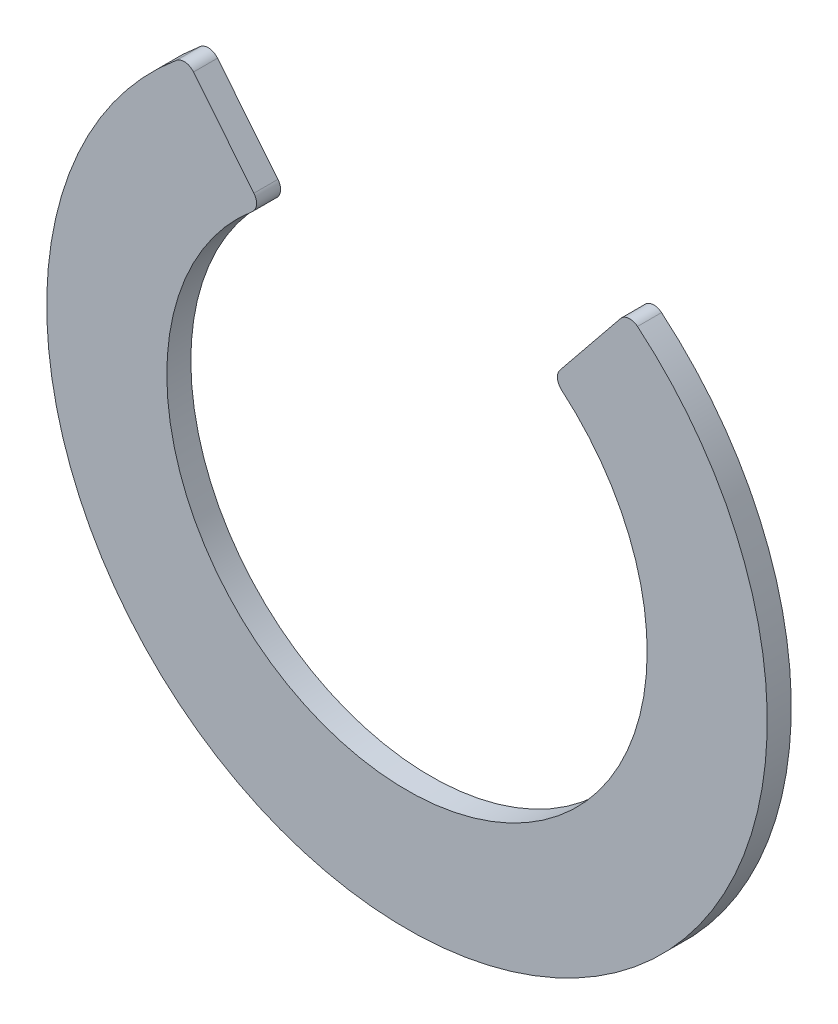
SolidWorks part; units mm, degrees
ref_plane "Front Plane" through (0, 0, 0) normal (0, 0, 1) x (1, 0, 0)
ref_plane "Top Plane" through (0, 0, 0) normal (0, 1, 0) x (1, 0, 0)
ref_plane "Right Plane" through (0, 0, 0) normal (1, 0, 0) x (0, 0, -1)
sketch "Sketch1" plane through (0, 0, 0) normal (0, 0, 1) x (1, 0, 0)
  line L0 (-1.7779, 2.2915) -> (-1.2748, 1.6693)
  line L1 (1.2748, 1.6693) -> (1.7779, 2.2915)
  arc A0 (1.9196, 2.3055) -> (-1.9196, 2.3055) centre (0, 0) cw
  arc A1 (1.2881, 1.5299) -> (-1.2881, 1.5299) centre (0, 0) cw
  arc A2 (-1.2881, 1.5299) -> (-1.2748, 1.6693) centre (-1.3526, 1.6064) ccw
  arc A3 (-1.9196, 2.3055) -> (-1.7779, 2.2915) centre (-1.8556, 2.2286) cw
  arc A4 (1.9196, 2.3055) -> (1.7779, 2.2915) centre (1.8556, 2.2286) ccw
  arc A5 (1.2881, 1.5299) -> (1.2748, 1.6693) centre (1.3526, 1.6064) cw
  point P8 (-1.2116, 1.5912)
  point P11 (-1.8406, 2.369)
  point P14 (1.8406, 2.369)
  point P17 (1.2116, 1.5912)
  dimension "D1" = 2
  dimension "D2" = 3
  dimension "D3" = 0.1
extrude "Boss-Extrude1" add sketch "Sketch1" along normal blind 0.2
